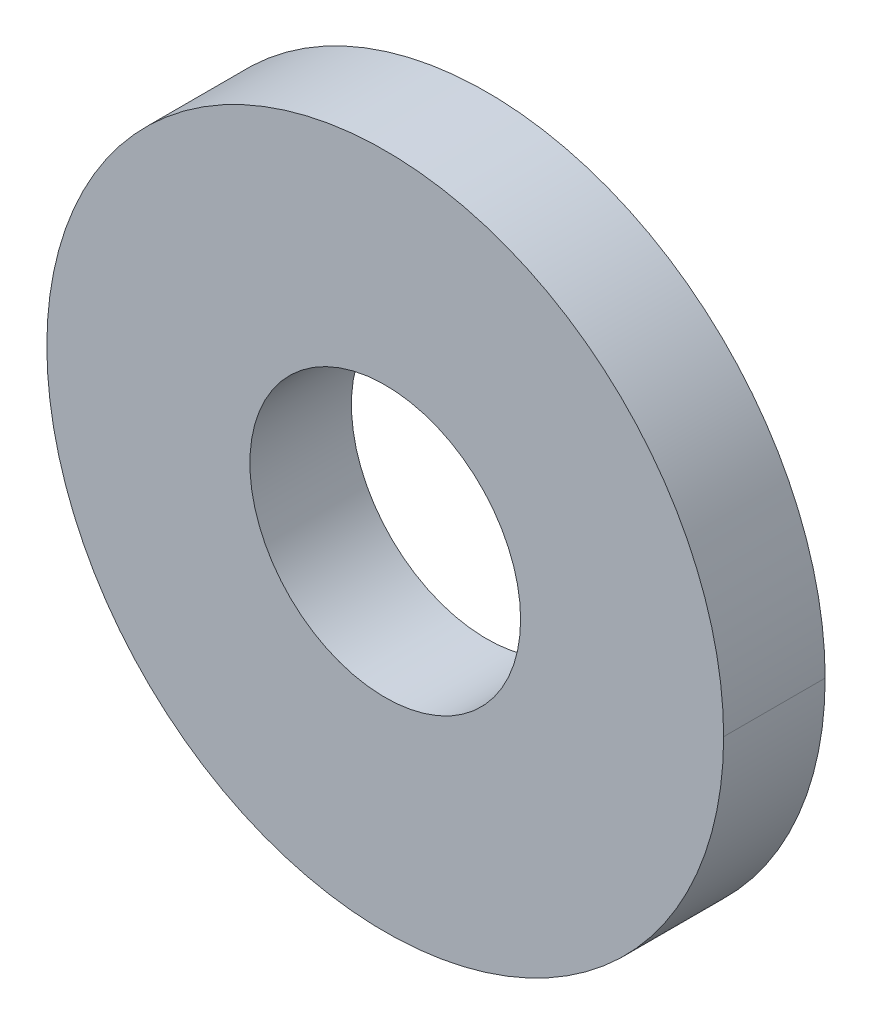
SolidWorks part; units mm, degrees
ref_plane "Front Plane" through (0, 0, 0) normal (0, 0, 1) x (1, 0, 0)
ref_plane "Top Plane" through (0, 0, 0) normal (0, 1, 0) x (1, 0, 0)
ref_plane "Right Plane" through (0, 0, 0) normal (1, 0, 0) x (0, 0, -1)
imported_body "Imported1"
sketch "Sketch1" plane through (0, 0, 3) normal (0, 0, 1) x (1, 0, 0)
  circle A0 centre (8.9312, 26.4578) radius 2
extrude "Cut-Extrude1" cut sketch "Sketch1" against normal blind 3
sketch "Sketch2" plane through (0, 0, 0) normal (1, 0, 0) x (0, 0, -1)
  line L0 (0, 31.4578) -> (-3, 31.4578) construction
  line L1 (-3, 31.4578) -> (-1.5, 31.4578)
  line L2 (-3, 31.4578) -> (-3, 21.3461)
  line L3 (-3, 21.3461) -> (-1.5, 21.3461)
  line L4 (-1.5, 31.4578) -> (-1.5, 21.3461)
  line L5 (-3, 31.4578) -> (-3, 26.4578) construction
extrude "Cut-Extrude2" cut sketch "Sketch2" along normal through all
